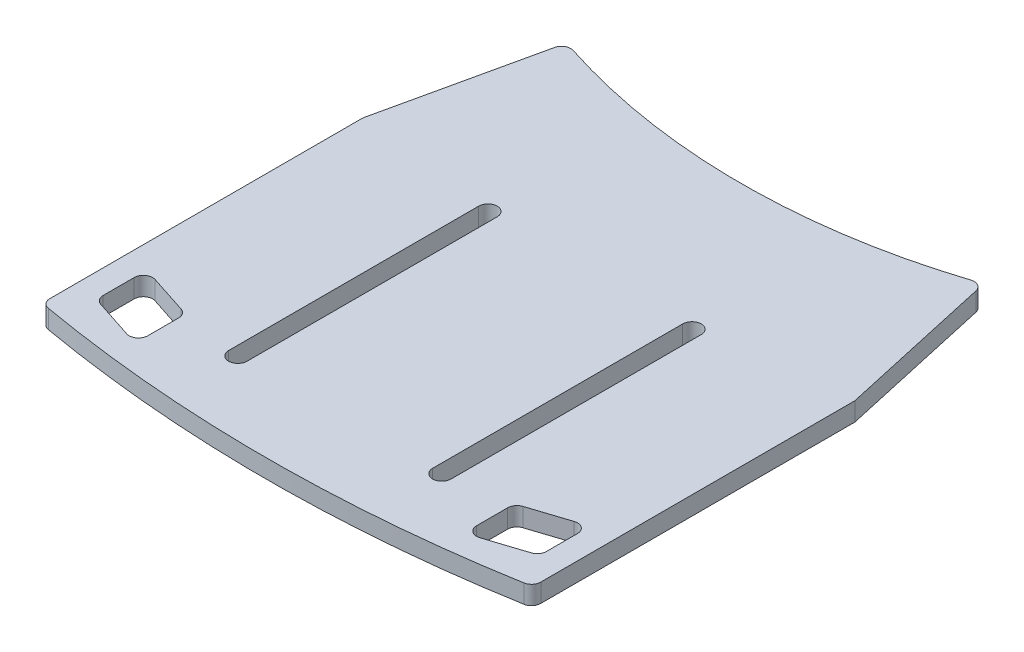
SolidWorks part; units mm, degrees
ref_plane "Plano frontal" through (0, 0, 0) normal (0, 0, 1) x (1, 0, 0)
ref_plane "Plano superior" through (0, 0, 0) normal (0, 1, 0) x (1, 0, 0)
ref_plane "Plano direito" through (0, 0, 0) normal (1, 0, 0) x (0, 0, -1)
sketch "Esboço1" plane through (0, 0, 0) normal (0, 1, 0) x (1, 0, 0)
  line L0 (-22.74, 26.42) -> (-26.4762, 9.6072)
  line L1 (0.0119, 0.0124) -> (0.0119, 37.2708) construction
  line L2 (-26.5, 9.3902) -> (-26.5, -24.2993)
  line L3 (23.9452, -17.7773) -> (23.9452, -21.1275)
  line L4 (26.5, 9.6072) -> (26.5, -24.2993)
  line L5 (-26.5, 27.5) -> (26.5, -27.5) construction
  line L6 (-26.4762, -27.4753) -> (26.5, 27.5) construction
  line L7 (-11, 7.5001) -> (-11, -19.4999) construction
  line L8 (-10, 7.5001) -> (-10, -19.4999)
  line L9 (-12, 7.5001) -> (-12, -19.4999)
  line L10 (-23.231, -22.0783) -> (-19.0524, -23.4392)
  line L11 (-17.7427, -22.4884) -> (-17.7427, -19.1382)
  line L12 (-18.433, -18.1874) -> (-22.6117, -16.8265)
  line L13 (-23.9213, -17.7773) -> (-23.9213, -21.1275)
  line L14 (23.2548, -22.0783) -> (19.0762, -23.4392)
  line L15 (18.4568, -18.1874) -> (22.6355, -16.8265)
  line L16 (17.7665, -22.4884) -> (17.7665, -19.1382)
  line L17 (11.0238, 7.5001) -> (11.0238, -19.4999) construction
  line L18 (10.0238, 7.5001) -> (10.0238, -19.4999)
  line L19 (12.0238, 7.5001) -> (12.0238, -19.4999)
  line L20 (22.7638, 26.42) -> (26.5, 9.6072)
  arc A0 (-25.6713, -25.2845) -> (25.6713, -25.2845) centre (0, 122.3384) ccw
  arc A1 (-21.4571, 27.1549) -> (0.0119, 23.7813) centre (0.0119, 93.7813) ccw
  arc A2 (-10, 7.5001) -> (-12, 7.5001) centre (-11, 7.5001) ccw
  arc A3 (-12, -19.4999) -> (-10, -19.4999) centre (-11, -19.4999) ccw
  arc A4 (-26.4762, 9.6072) -> (-26.5, 9.3902) centre (-25.5, 9.3902) ccw
  arc A5 (-22.74, 26.42) -> (-21.4571, 27.1549) centre (-21.7638, 26.2031) cw
  arc A6 (-17.7427, -19.1382) -> (-18.433, -18.1874) centre (-18.7427, -19.1382) ccw
  arc A7 (-22.6117, -16.8265) -> (-23.9213, -17.7773) centre (-22.9213, -17.7773) ccw
  arc A8 (-23.231, -22.0783) -> (-23.9213, -21.1275) centre (-22.9213, -21.1275) cw
  arc A9 (-19.0524, -23.4392) -> (-17.7427, -22.4884) centre (-18.7427, -22.4884) ccw
  arc A10 (-25.6713, -25.2845) -> (-26.5, -24.2993) centre (-25.5, -24.2993) cw
  arc A11 (25.6713, -25.2845) -> (26.5, -24.2993) centre (25.5, -24.2993) ccw
  arc A12 (19.0762, -23.4392) -> (17.7665, -22.4884) centre (18.7665, -22.4884) cw
  arc A13 (23.2548, -22.0783) -> (23.9452, -21.1275) centre (22.9452, -21.1275) ccw
  arc A14 (22.6355, -16.8265) -> (23.9452, -17.7773) centre (22.9452, -17.7773) cw
  arc A15 (17.7665, -19.1382) -> (18.4568, -18.1874) centre (18.7665, -19.1382) cw
  arc A16 (10.0238, 7.5001) -> (12.0238, 7.5001) centre (11.0238, 7.5001) cw
  arc A17 (12.0238, -19.4999) -> (10.0238, -19.4999) centre (11.0238, -19.4999) cw
  arc A18 (22.7638, 26.42) -> (21.4809, 27.1549) centre (21.7876, 26.2031) ccw
  arc A19 (21.4809, 27.1549) -> (0.0119, 23.7813) centre (0.0119, 93.7813) cw
  point P0 (0, 0)
  point P17 (-11, -5.9999)
  point P30 (-22.5, 27.5)
  point P33 (-17.7427, -18.4122)
  point P56 (17.7665, -18.4122)
  point P59 (11.0238, -5.9999)
  dimension "D4" = 29
  dimension "D7" = 1
  dimension "D8" = 1
  dimension "D5" = 1
  dimension "D9" = 70
  dimension "D1" = 2
  dimension "D2" = 53
  dimension "D3" = 4
  dimension "D6" = 10
extrude "Ressalto-extrusão1" add sketch "Esboço1" along normal blind 2
